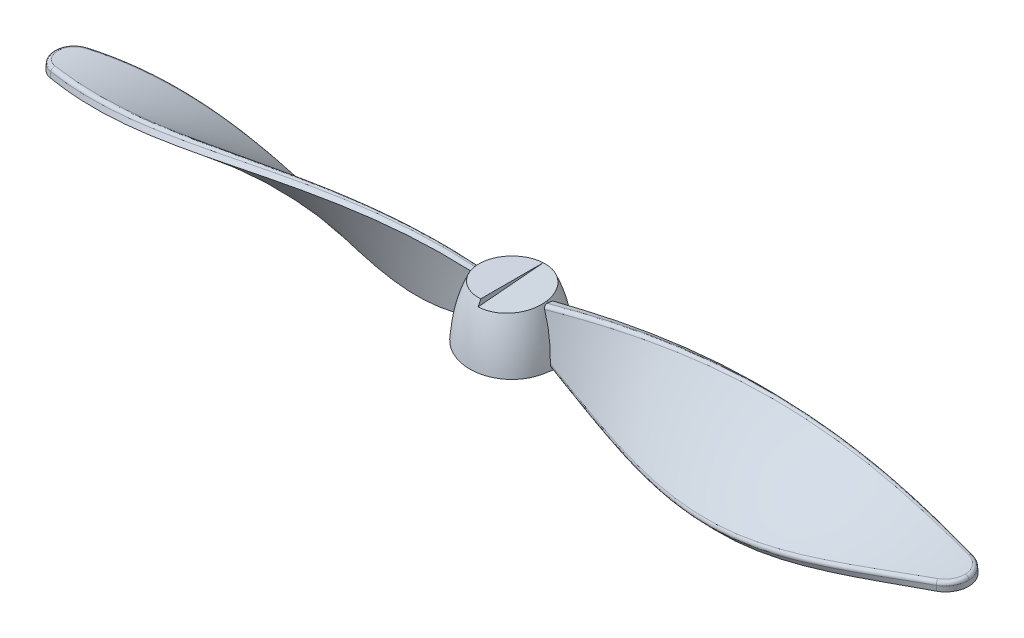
SolidWorks part; units mm, degrees
ref_plane "Plan1" through (0, 0, 0) normal (0, 0, 1) x (1, 0, 0)
ref_plane "Plan2" through (0, 0, 0) normal (0, 1, 0) x (1, 0, 0)
ref_plane "Plan3" through (0, 0, 0) normal (1, 0, 0) x (0, 0, -1)
sketch "Esquisse1" plane through (0, 0, 0) normal (0, 0, 1) x (1, 0, 0)
  line L0 (0, 0) -> (10.5, 0)
  line L1 (0, 21.104) -> (0, 0)
  arc A0 (10.5, 0) -> (2.8072, 19.751) centre (-25.1465, -2.5104) ccw
  arc A1 (2.8072, 19.751) -> (0, 21.104) centre (0, 17.5154) ccw
revolve "Révolution2" add sketch "Esquisse1" angle 360 about L1
sketch "Esquisse2" plane through (0, 0, 0) normal (0, 0, 1) x (1, 0, 0)
  line L0 (-7.5101, 11.9989) -> (-10.3852, 1.2937)
  arc A0 (-7.5101, 11.9989) -> (-100, 10.3839) centre (-50, -203.859) ccw
  arc A1 (-2.8072, 19.751) -> (-10.5, 0) centre (25.1465, -2.5104) ccw construction
  arc A2 (-10.3852, 1.2937) -> (-100.7132, 1.2937) centre (-55.5492, 112.4702) cw
  arc A3 (-100, 10.3839) -> (-100.7132, 1.2937) centre (-98.9128, 5.7255) ccw
  dimension "D1" = 220
  dimension "D6" = 120
  dimension "D2" = 11.9989
  dimension "D3" = 50
  dimension "D4" = 100
extrude "Extrusion1" add sketch "Esquisse2" along normal mid plane 2
mirror "Symétrie1" about plane through (0, 0, 0) normal (1, 0, 0) of "Extrusion1"
fillet "Congé1" radius 0.8 14 edges at (-7.5622, 11.805, -1) (-10.3439, 1.4478, -1) (-103.6817, 6.0997, -1) (-55.5492, -7.5298, -1) (-53.8409, 16.1075, -1) (7.5429, 11.8771, 0.5651) (-10.5389, -2.1264, 1) (7.5622, 11.805, 1) (10.3439, 1.4478, 1) (103.6817, 6.0997, 1) (53.8409, 16.1075, 1) (55.5492, -7.5298, 1) (10.3893, -5.792, -1) (-10.3689, 1.3544, -0.4497)
other "Flexion4" parameters "D0"=177, "D1"=0, "D2"=0
sketch "Esquisse3" plane through (0, 0, 0) normal (0, 0, 1) x (1, 0, 0)
  line L0 (-10.3853, 1.1926) -> (10.3657, 1.1926)
  line L1 (-10.3853, 1.1926) -> (-11.5925, -1.694)
  line L2 (10.3657, 1.1926) -> (11.9524, -1.694)
  line L3 (-11.5925, -1.694) -> (11.9524, -1.694)
extrude "Enlèv. mat.-Extru.1" cut sketch "Esquisse3" against normal mid plane 25
sketch "Esquisse4" plane through (0, 0, 0) normal (0, 0, 1) x (1, 0, 0)
  line L0 (9.1314, 21.98) -> (-8.8172, 21.98)
  line L1 (-8.8172, 21.98) -> (-8.8172, 12.8983)
  line L2 (-8.8172, 12.8983) -> (9.1314, 12.8983)
  line L3 (9.1314, 12.8983) -> (9.1314, 21.98)
extrude "Enlèv. mat.-Extru.2" cut sketch "Esquisse4" against normal mid plane 25
sketch "Esquisse5" plane through (0, 0, 0) normal (0, 0, 1) x (1, 0, 0)
  line L0 (0, 0) -> (59.697, 0) construction
ref_plane "Plan4" through (0, 0, 0) normal (0, 0.0872, -0.9962) x (-1, 0, 0)
sketch "Esquisse6" plane through (0, 0, 0) normal (0, 0.0872, -0.9962) x (-1, 0, 0)
  line L0 (0, 12.2312) -> (-7.7872, 12.2312)
  line L1 (-7.7872, 12.2312) -> (-7.7872, 16.6288)
  line L2 (-7.7872, 16.6288) -> (0, 16.6288)
  line L3 (0, 16.6288) -> (0, 12.2312)
  spline S0 degree 3 poles (-7.0762, 12.783) (-7.0527, 12.7423) (-6.9835, 12.7024) (-6.8124, 12.6438) (-6.7441, 12.6244) (-6.5832, 12.5861) (-6.491, 12.5674) (-6.1846, 12.513) (-5.9392, 12.4789) (-5.5071, 12.4312) (-5.3512, 12.4158) (-5.0243, 12.3868) (-4.6819, 12.3596) (-4.309, 12.3357) (-3.9206, 12.3135) (-3.7174, 12.3032) (-3.0931, 12.2754) (-2.6606, 12.261) (-1.7643, 12.24) (-1.2974, 12.2335) (-0.3715, 12.2288) (0.0919, 12.2304) (1.0198, 12.2411) (1.4732, 12.2502) (2.1315, 12.2693) (2.3477, 12.2766) (2.7735, 12.2929) (2.9841, 12.3021) (3.5946, 12.3317) (3.9761, 12.3545) (4.6895, 12.406) (5.024, 12.435) (5.62, 12.497) (5.8836, 12.53) (6.3409, 12.6004) (6.5347, 12.6379) (6.8348, 12.7142) (6.9434, 12.7533) (7.0431, 12.8135) (7.0657, 12.8339) (7.0881, 12.8746) (7.088, 12.895) (7.0762, 12.9154) knots 0 0 0 0 0.0625 0.0625 0.09375 0.09375 0.125 0.125 0.1875 0.1875 0.21875 0.21875 0.25 0.28125 0.28125 0.3125 0.3125 0.375 0.375 0.4375 0.4375 0.5 0.5 0.5625 0.5625 0.59375 0.59375 0.625 0.625 0.6875 0.6875 0.75 0.75 0.8125 0.8125 0.875 0.875 0.9375 0.9375 0.96875 0.96875 1 1 1 1 construction
extrude "Enlèv. mat.-Extru.3" cut sketch "Esquisse6" against normal mid plane 25
